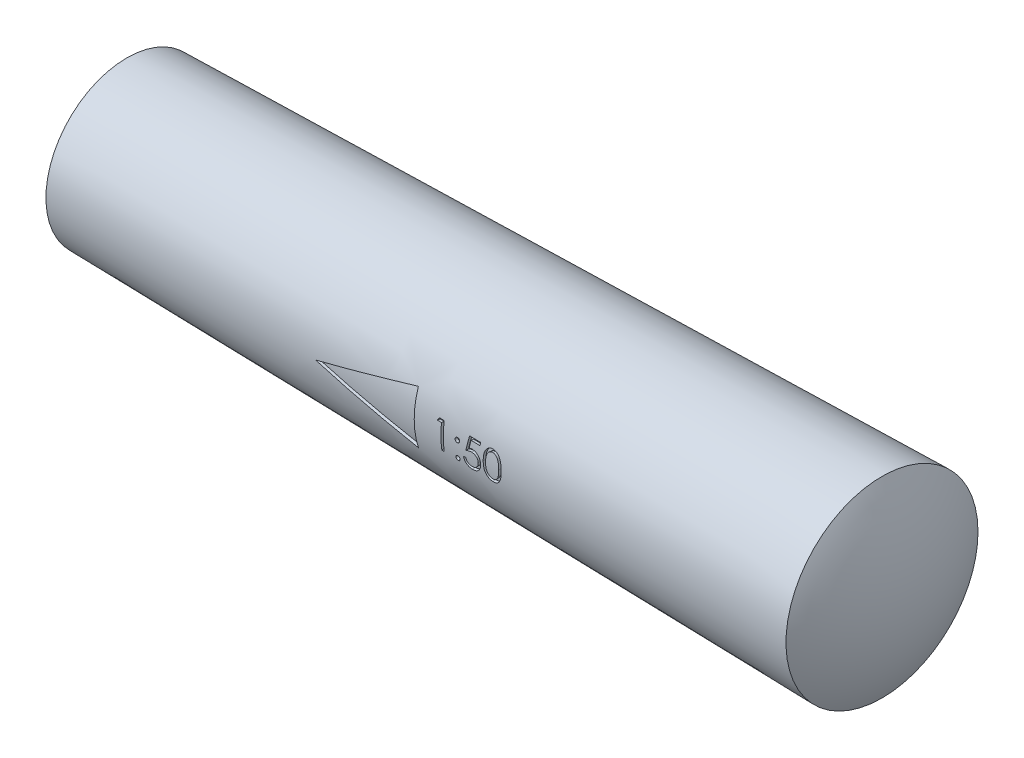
SolidWorks part; units mm, degrees
ref_plane "Front Plane" through (0, 0, 0) normal (0, 0, 1) x (1, 0, 0)
ref_plane "Top Plane" through (0, 0, 0) normal (0, 1, 0) x (1, 0, 0)
ref_plane "Right Plane" through (0, 0, 0) normal (1, 0, 0) x (0, 0, -1)
sketch "Sketch1" plane through (0, 0, 0) normal (1, 0, 0) x (0, 0, -1)
  circle A0 centre (0, 0) radius 3
  dimension "D1" = 6
extrude "Extrude1" add sketch "Sketch1" along normal mid plane 28
draft "Draft1" type of draft neutral plane draft angle 1.146 faces to draft 1 parameters "D1"=1.146
sketch "Sketch2" plane through (0, 0, 0) normal (0, 0, 1) x (1, 0, 0)
  line L0 (-14, 0) -> (-14, 3)
  line L1 (-14, 3) -> (-14, -3) construction
  line L2 (-14, 0) -> (-14.9, 0)
  line L3 (-14.9, 0) -> (-14.9, -3.28) construction
  line L4 (14, 0) -> (14, 3.56)
  line L5 (14, -3.56) -> (14, 3.56) construction
  line L6 (14, 0) -> (14.9, 0)
  line L7 (14.9, 0) -> (14.9, -3.28) construction
  line L8 (-14, -3) -> (14, -3.56) construction
  arc A0 (-14.9, 0) -> (-14, 3) centre (-9.45, 0) cw
  arc A1 (14.9, 0) -> (14, 3.56) centre (7.409, 0) ccw
  point P14 (0, -3.28)
revolve "Revolve1" add sketch "Sketch2" angle 360 about L2
sketch "Sketch5" plane through (0, 0, 0) normal (0, 0, 1) x (1, 0, 0)
  line L0 (0, 3.28) -> (0, -3.28) construction
  line L1 (14, 3.56) -> (-14, 3) construction
  line L2 (-14, -3) -> (14, -3.56) construction
ref_plane "Plane2" through (0, 0, 0) normal (-0.02, 0, 0.9998) x (0.9998, 0, 0.02)
sketch "Sketch6" plane through (0, 0, 0) normal (-0.02, 0, 0.9998) x (0.9998, 0, 0.02)
  line L0 (0, 0) -> (0, 1)
  line L1 (0, 3.28) -> (0, -3.28) construction
  line L2 (0, 1) -> (-3.7321, 0)
  line L3 (-3.7321, 0) -> (0, -1)
  line L4 (0, -1) -> (0, 0)
  line L5 (0, -0.5) -> (4, -0.5) construction
  text T0 "1:50" font "Century Gothic" height 1
  dimension "D1" = 2
  dimension "D2" = 30
  dimension "D3" = 4
wrap "Wrap2" sketch "Sketch6" wrap type deboss source sketch "Sketch6" thickness 0.1 parameters "D1"=0.1
equation "\"D2@Sketch2\" = \"D1@Sketch2\""
